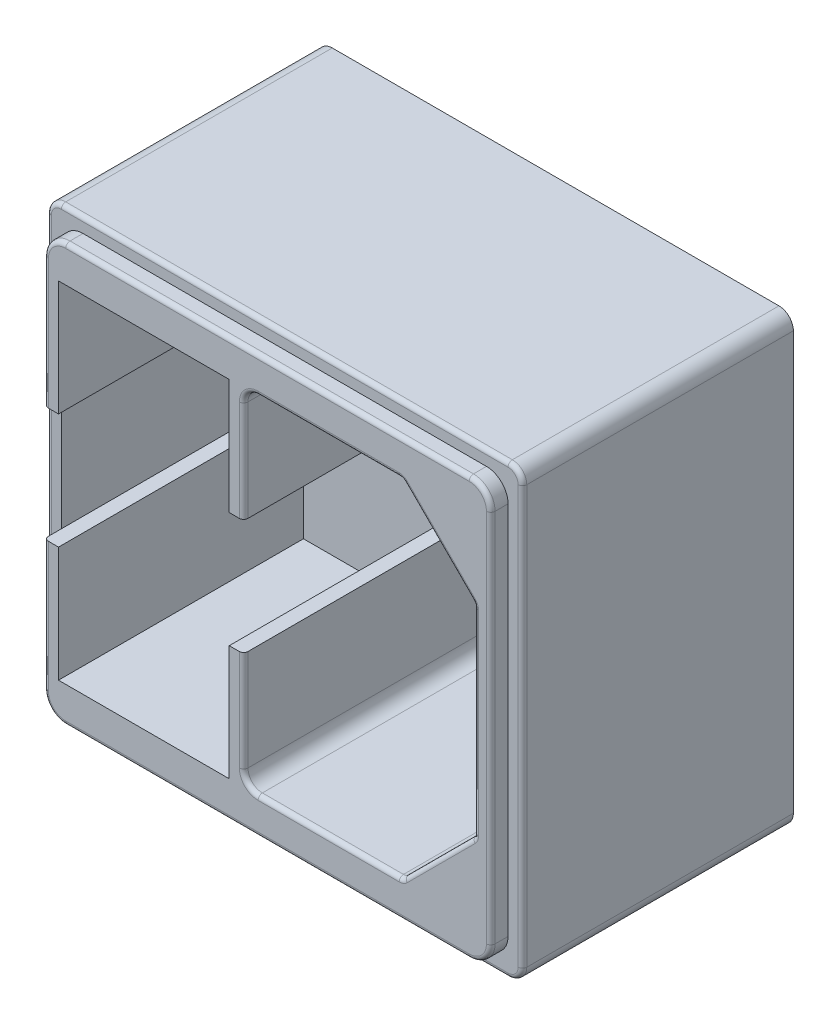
SolidWorks part; units mm, degrees
ref_plane "Plan de face" through (0, 0, 0) normal (0, 0, 1) x (1, 0, 0)
ref_plane "Plan de dessus" through (0, 0, 0) normal (0, 1, 0) x (1, 0, 0)
ref_plane "Plan de droite" through (0, 0, 0) normal (1, 0, 0) x (0, 0, -1)
sketch "Esquisse1" plane through (0, 0, 0) normal (0, 0, 1) x (1, 0, 0)
  line L1 (1, 0) -> (32, 0)
  line L2 (0, 1) -> (0, 30)
  line L3 (1, 31) -> (32, 31)
  line L4 (33, 1) -> (33, 30)
  arc A0 (0, 30) -> (1, 31) centre (1, 30) cw
  arc A1 (33, 30) -> (32, 31) centre (32, 30) ccw
  arc A2 (32, 0) -> (33, 1) centre (32, 1) ccw
  arc A3 (0, 1) -> (1, 0) centre (1, 1) ccw
  point P7 (0, 31)
  point P12 (33, 0)
  point P15 (0, 0)
  dimension "D3" = 1
  dimension "D1" = 33
  dimension "D2" = 31
extrude "Extrusion1" add sketch "Esquisse1" along normal blind 20
sketch "Esquisse2" plane through (0, 0, 20) normal (0, 0, 1) x (1, 0, 0)
  line L0 (30.8491, 30) -> (30.8491, 1) construction
  line L1 (30.8491, 22.2929) -> (30.8491, 8.7071)
  line L2 (32, 15.5) -> (7.8521, 15.5) construction
  line L3 (25.642, 27.5) -> (15.8491, 27.5)
  line L4 (25.642, 3.5) -> (15.8491, 3.5)
  line L5 (14.8491, 26.5) -> (14.8491, 4.5)
  line L7 (14.8491, 30) -> (14.8491, 1) construction
  line L8 (32, 27.5) -> (7.8521, 27.5) construction
  line L9 (32, 3.5) -> (7.8521, 3.5) construction
  line L10 (30.7027, 22.6464) -> (25.9956, 27.3536)
  line L11 (30.7027, 8.3536) -> (25.9956, 3.6464)
  arc A0 (14.8491, 26.5) -> (15.8491, 27.5) centre (15.8491, 26.5) cw
  arc A1 (15.8491, 3.5) -> (14.8491, 4.5) centre (15.8491, 4.5) cw
  arc A2 (25.9956, 27.3536) -> (25.642, 27.5) centre (25.642, 27) ccw
  arc A3 (30.8491, 22.2929) -> (30.7027, 22.6464) centre (30.3491, 22.2929) ccw
  arc A4 (30.7027, 8.3536) -> (30.8491, 8.7071) centre (30.3491, 8.7071) ccw
  arc A5 (25.642, 3.5) -> (25.9956, 3.6464) centre (25.642, 4) ccw
  dimension "D1" = 1
  dimension "D6" = 0.5
  dimension "D2" = 12
  dimension "D3" = 12
  dimension "D4" = 16
extrude "Enlèv. mat.-Extru.1" cut sketch "Esquisse2" against normal blind 17
sketch "Esquisse3" plane through (0, 0, 3) normal (0, 0, 1) x (1, 0, 0)
  line L6 (18.4008, 26.0887) -> (18.4008, 24.4887)
  line L7 (22.4008, 26.0887) -> (22.4008, 24.4887)
  line L8 (30.4359, 16.3) -> (26.4359, 16.3)
  line L9 (30.4359, 14.7) -> (26.4359, 14.7)
  line L11 (18.4008, 24.4887) -> (22.4008, 24.4887)
  line L12 (18.4008, 26.0887) -> (22.4008, 26.0887)
  line L13 (18.4008, 6.5113) -> (22.4008, 6.5113)
  line L14 (18.4008, 4.9113) -> (22.4008, 4.9113)
  line L15 (26.4359, 16.3) -> (26.4359, 14.7)
  line L16 (30.4359, 16.3) -> (30.4359, 14.7)
  line L21 (26.4359, 17.8184) -> (26.4359, 12.5928) construction
  line L22 (30.4359, 17.8184) -> (30.4359, 12.5928) construction
  line L27 (22.4008, 6.5113) -> (22.4008, 4.9113)
  line L30 (18.4008, 6.5113) -> (18.4008, 4.9113)
  dimension "D7" = 4
extrude "Enlèv. mat.-Extru.2" cut sketch "Esquisse3" against normal up to next
sketch "Esquisse4" plane through (0, 0, 20) normal (0, 0, 1) x (1, 0, 0)
  line L0 (13.8491, 27.5) -> (2, 27.5)
  line L1 (13.8491, 3.5) -> (2, 3.5)
  line L2 (14.8491, 19.5) -> (14.8491, 11.5)
  line L5 (2, 27.5) -> (2, 19.5)
  line L6 (13.8491, 27.5) -> (13.8491, 19.5)
  line L8 (1, 19.5) -> (1, 11.5)
  line L9 (14.8491, 19.5) -> (13.8491, 19.5)
  line L10 (14.8491, 11.5) -> (13.8491, 11.5)
  line L11 (13.8491, 11.5) -> (13.8491, 3.5)
  line L12 (13.8491, 27.5) -> (13.8491, 3.5) construction
  line L13 (14.8491, 27.5) -> (14.8491, 3.5) construction
  line L14 (1, 27.5) -> (1, 3.5) construction
  line L21 (2, 11.5) -> (2, 3.5)
  line L22 (2, 27.5) -> (2, 3.5) construction
  line L23 (2, 11.5) -> (1, 11.5)
  line L24 (2, 19.5) -> (1, 19.5)
  dimension "D2" = 1
  dimension "D3" = 1
extrude "Enlèv. mat.-Extru.3" cut sketch "Esquisse4" against normal blind 17
sketch "Esquisse6" plane through (0, 0, 20) normal (0, 0, 1) x (1, 0, 0)
  line L4 (30.5, 30) -> (2.5, 30)
  line L5 (1, 28.5) -> (1, 2.5)
  line L6 (32, 28.5) -> (32, 2.5)
  line L7 (30.5, 1) -> (2.5, 1)
  arc A0 (1, 28.5) -> (2.5, 30) centre (2.5, 28.5) cw
  arc A1 (2.5, 1) -> (1, 2.5) centre (2.5, 2.5) cw
  arc A2 (32, 2.5) -> (30.5, 1) centre (30.5, 2.5) cw
  arc A3 (30.5, 30) -> (32, 28.5) centre (30.5, 28.5) cw
  dimension "D1" = 1.5
extrude "Enlèv. mat.-Extru.4" cut sketch "Esquisse6" against normal blind 1.2 flip side to cut
fillet "Congé1" radius 0.3 9 edges at (1, 7, 20) (1.4393, 1.4393, 20) (16.5, 1, 20) (31.5607, 1.4393, 20) (32, 15.5, 20) (31.5607, 29.5607, 20) (1, 24, 20) (1.4393, 29.5607, 20) (16.5, 30, 20)
fillet "Congé2" radius 0.3 8 edges at (32.7071, 30.7071, 18.8) (33, 15.5, 18.8) (32.7071, 0.2929, 18.8) (16.5, 0, 18.8) (0.2929, 0.2929, 18.8) (0, 15.5, 18.8) (0.2929, 30.7071, 18.8) (16.5, 31, 18.8)
fillet "Congé3" radius 0.3 13 edges at (14.8491, 8, 20) (15.142, 3.7929, 20) (20.7456, 3.5, 20) (25.8334, 3.5381, 20) (28.3491, 6, 20) (30.8111, 8.5158, 20) (30.8491, 15.5, 20) (30.8111, 22.4842, 20) (14.8491, 23, 20) (15.142, 27.2071, 20) (20.7456, 27.5, 20) (25.8334, 27.4619, 20) (28.3491, 25, 20)
